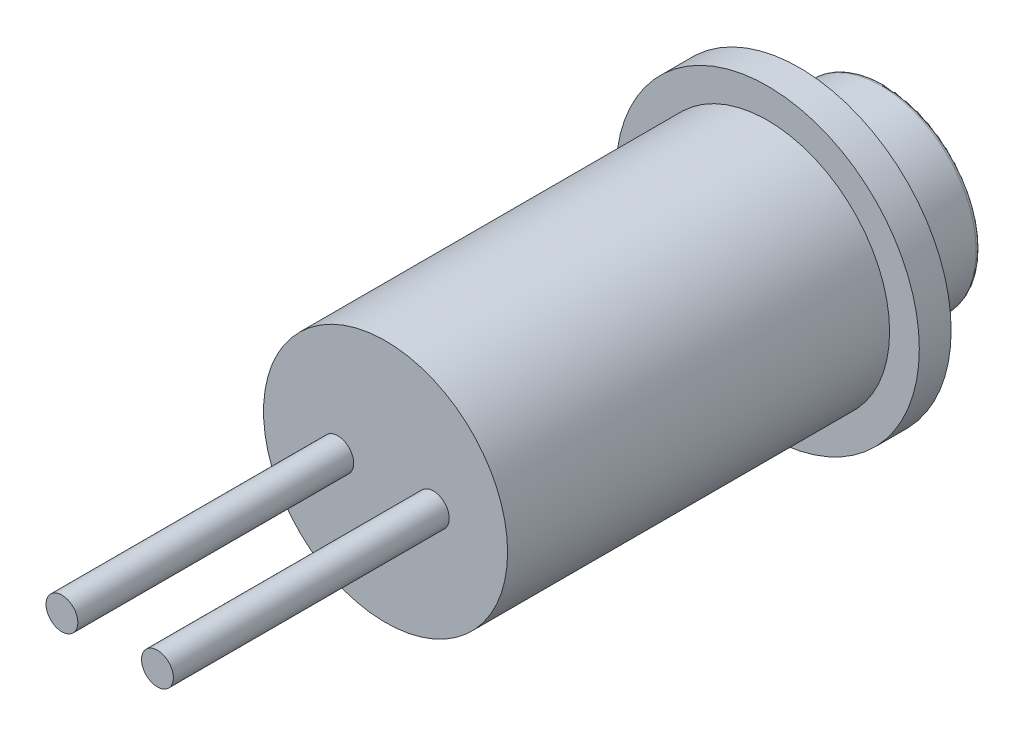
SolidWorks part; units mm, degrees
ref_plane "Plan de face" through (0, 0, 0) normal (0, 0, 1) x (1, 0, 0)
ref_plane "Plan de dessus" through (0, 0, 0) normal (0, 1, 0) x (1, 0, 0)
ref_plane "Plan de droite" through (0, 0, 0) normal (1, 0, 0) x (0, 0, -1)
sketch "Esquisse1" plane through (0, 0, 0) normal (0, 0, 1) x (1, 0, 0)
  circle A0 centre (0, 0) radius 5.75
  dimension "D1" = 11.5
extrude "Boss.-Extru.1" add sketch "Esquisse1" along normal blind 18
sketch "Esquisse2" plane through (0, 0, 0) normal (0, 0, 1) x (1, 0, 0)
  circle A0 centre (0, 0) radius 7.15
  dimension "D1" = 14.3
extrude "Boss.-Extru.2" add sketch "Esquisse2" against normal blind 2.5
chamfer "Chanfrein1" distance 1.5 distance2 1 1 edges at (7.15, 0, -2.5)
sketch "Esquisse3" plane through (0, 0, 0) normal (0, 1, 0) x (1, 0, 0)
  line L0 (0, 0) -> (0, 13.3411) construction
  line L1 (0, 2.5) -> (-4.5, 2.5)
  line L2 (5.65, 2.5) -> (-5.65, 2.5) construction
  line L3 (-4.5, 2.5) -> (-4.5, 5.5)
  line L4 (-4.5, 5.5) -> (0, 5.5) construction
  line L5 (0, 5.9083) -> (0, 2.5)
  arc A0 (0, 5.9083) -> (-4.5, 5.5) centre (0, -19.0917) ccw
revolve "Révolution1" add sketch "Esquisse3" angle 360 about L0
fillet "Congé1" radius 0.2 1 edges at (4.5, 0, -5.5)
sketch "Esquisse4" plane through (0, 0, 18) normal (0, 0, 1) x (1, 0, 0)
  line L0 (0, 0) -> (0, 3.3215) construction
  line L1 (0, 0) -> (3.8817, 0) construction
  circle A0 centre (2.25, 0) radius 0.75
  circle A1 centre (-2.25, 0) radius 0.75
  dimension "D1" = 2.25
  dimension "D2" = 1.5
extrude "Boss.-Extru.3" add sketch "Esquisse4" along normal blind 13
equation "\"D2@Esquisse3\"=9/2"
